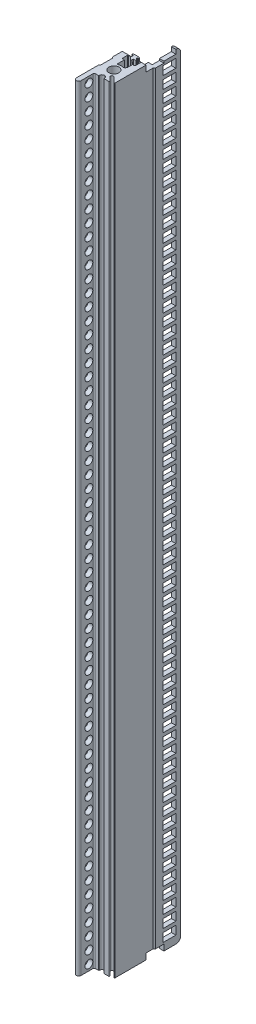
SolidWorks part; units mm, degrees
ref_plane "前视基准面" through (0, 0, 0) normal (0, 0, 1) x (1, 0, 0)
ref_plane "上视基准面" through (0, 0, 0) normal (0, 1, 0) x (1, 0, 0)
ref_plane "右视基准面" through (0, 0, 0) normal (1, 0, 0) x (0, 0, -1)
sketch "草图1" plane through (0, 0, 0) normal (0, 1, 0) x (1, 0, 0)
  line L0 (-4.2, 11.9) -> (-3.9, 11.9)
  line L1 (-4.4, 12.2) -> (-4.4, 12.1)
  line L2 (-4.0328, 12.4) -> (-4.2, 12.4)
  line L3 (-3.85, 12.5) -> (-3.8914, 12.4586)
  line L4 (-2.05, 12.5) -> (-3.85, 12.5)
  line L5 (-2.0086, 12.4586) -> (-2.05, 12.5)
  line L6 (-1.7, 12.4) -> (-1.8672, 12.4)
  line L7 (-1.5, 12.1) -> (-1.5, 12.2)
  line L8 (-1.8, 11.9) -> (-1.7, 11.9)
  line L9 (-2, 11.4828) -> (-2, 11.7)
  line L10 (-1.3586, 10.7586) -> (-1.9414, 11.3414)
  line L11 (-1.3, 10.55) -> (-1.3, 10.6172)
  line L12 (-3.7, 11.7) -> (-3.7, 9.95)
  line L13 (-5, -10.75) -> (-5, -1.6)
  line L14 (-3, -10.75) -> (-3, -5.75)
  line L15 (-2.5, -5.25) -> (-1.15, -5.25)
  line L16 (1.6887, -3.3855) -> (3.2118, -4.9086)
  line L17 (2.5373, -2.537) -> (4.6586, -4.6583)
  line L18 (5, 15) -> (5, 5.1793)
  line L19 (3.6, 15) -> (5, 15)
  line L20 (3.6, 12.5) -> (3.6, 15)
  line L21 (1.95, 12.5) -> (3.6, 12.5)
  line L22 (1.95, 10.55) -> (1.95, 12.5)
  line L23 (2.85, 10.55) -> (1.95, 10.55)
  line L24 (2.85, 9.35) -> (2.85, 10.55)
  line L25 (1.95, 9.35) -> (2.85, 9.35)
  line L26 (1.95, 8.35) -> (1.95, 9.35)
  line L27 (2.85, 8.35) -> (1.95, 8.35)
  line L28 (2.85, 6.05) -> (2.85, 8.35)
  line L29 (1.95, 6.05) -> (2.85, 6.05)
  line L30 (1.95, 3.8856) -> (1.95, 6.05)
  line L31 (-1.45, 6.05) -> (-1.45, 2.9458)
  line L32 (-2.35, 6.05) -> (-1.45, 6.05)
  line L33 (-2.35, 8.35) -> (-2.35, 6.05)
  line L34 (-1.45, 8.35) -> (-2.35, 8.35)
  line L35 (-1.45, 9.35) -> (-1.45, 8.35)
  line L36 (-2.35, 9.35) -> (-1.45, 9.35)
  line L37 (-2.35, 10.55) -> (-2.35, 9.35)
  line L38 (-1.3, 10.55) -> (-2.35, 10.55)
  line L39 (-4.45, 7.7) -> (-4.7, 7.7) construction
  line L40 (-5, 7.4) -> (-4.7, 7.7) construction
  line L41 (-5, 4.4) -> (-5, 7.4)
  line L42 (-4.5499, 3.8998) -> (-5, 4.4)
  line L43 (-4.45, 8.5) -> (-4.45, 9.55)
  line L44 (-3.9, 9.75) -> (-4.25, 9.75)
  line L45 (-4.5499, 3.8998) -> (-4.5501, -1.1002)
  line L46 (-5, -1.6) -> (-4.5501, -1.1002)
  line L47 (4.9414, -1.9395) -> (4.6464, -1.6446) construction
  line L48 (5, -2.081) -> (5, -4.5169)
  line L49 (0, 0) -> (0, -5) construction
  line L50 (4.5, -1.291) -> (4.5, 4.3894) construction
  line L51 (-1.05, -5) -> (-1.05, -5.15)
  line L52 (1.05, -5) -> (1.05, -5.15)
  line L53 (1.15, -5.25) -> (3.0703, -5.25)
  line L54 (2.5373, -2.537) -> (1.6887, -3.3855) construction
  line L55 (5, 5.1793) -> (5, -2.081)
  line L56 (-4.45, 8.5) -> (-4.7, 8.5)
  line L57 (-4.7, 8.5) -> (-5, 8.2)
  line L58 (4.9414, 5.0379) -> (4.6464, 4.743) construction
  line L59 (-5, 8.2) -> (-5, 7.4)
  circle A0 centre (0, 0) radius 1.6
  arc A1 (-4.4, 12.1) -> (-4.2, 11.9) centre (-4.2, 12.1) ccw
  arc A2 (-4.2, 12.4) -> (-4.4, 12.2) centre (-4.2, 12.2) ccw
  arc A3 (-4.0328, 12.4) -> (-3.8914, 12.4586) centre (-4.0328, 12.6) ccw
  arc A4 (-2.0086, 12.4586) -> (-1.8672, 12.4) centre (-1.8672, 12.6) ccw
  arc A5 (-1.5, 12.2) -> (-1.7, 12.4) centre (-1.7, 12.2) ccw
  arc A6 (-1.7, 11.9) -> (-1.5, 12.1) centre (-1.7, 12.1) ccw
  arc A7 (-1.8, 11.9) -> (-2, 11.7) centre (-1.8, 11.7) ccw
  arc A8 (-2, 11.4828) -> (-1.9414, 11.3414) centre (-1.8, 11.4828) ccw
  arc A9 (-1.3, 10.6172) -> (-1.3586, 10.7586) centre (-1.5, 10.6172) ccw
  arc A10 (-5, -10.75) -> (-3, -10.75) centre (-4, -10.75) ccw
  arc A11 (3.0703, -5.25) -> (3.2118, -4.9086) centre (3.0703, -5.05) ccw
  arc A12 (-4.25, 9.75) -> (-4.45, 9.55) centre (-4.25, 9.55) ccw
  arc A13 (-3.9, 9.75) -> (-3.7, 9.95) centre (-3.9, 9.95) ccw
  arc A14 (5, -2.081) -> (4.9414, -1.9395) centre (4.8, -2.081) ccw construction
  arc A15 (4.9414, 5.0379) -> (5, 5.1793) centre (4.8, 5.1793) ccw construction
  arc A16 (4.6586, -4.6583) -> (5, -4.5169) centre (4.8, -4.5169) ccw
  arc A17 (2.5373, -2.537) -> (1.6887, -3.3855) centre (2.113, -2.9613) ccw
  arc A18 (0.7125, 2.9142) -> (-1.1719, 2.7616) centre (0, 0) ccw
  arc A19 (-1.45, 2.9458) -> (-1.1719, 2.7616) centre (-1.25, 2.9458) ccw
  arc A20 (0.7125, 2.9142) -> (1.95, 3.8856) centre (0.95, 3.8856) ccw
  arc A21 (-3.7, 11.7) -> (-3.9, 11.9) centre (-3.9, 11.7) ccw
  arc A22 (4.6464, -1.6446) -> (4.5, -1.291) centre (5, -1.291) cw construction
  arc A23 (4.5, 4.3894) -> (4.6464, 4.743) centre (5, 4.3894) cw construction
  arc A24 (1.05, -5) -> (-1.05, -5) centre (0, -5) ccw
  arc A25 (1.15, -5.25) -> (1.05, -5.15) centre (1.15, -5.15) cw
  arc A26 (-1.05, -5.15) -> (-1.15, -5.25) centre (-1.15, -5.15) cw
  arc A29 (-3, -5.75) -> (-2.5, -5.25) centre (-2.5, -5.75) cw
  point P104 (1.05, -5.25)
  dimension "D1" = 3.2
  dimension "D2" = 2.1
  dimension "D3" = 5.2
  dimension "D4" = 45
  dimension "D5" = 1.2
  dimension "D7" = 0.6
  dimension "D8" = 0.2
  dimension "D10" = 5
  dimension "D11" = 0.1
  dimension "D12" = 0.5
  dimension "D13" = 0.5
  dimension "D6" = 3
  dimension "D9" = 2.1225
  dimension "D14" = 0.25
  dimension "D15" = 0.8
extrude "凸台-拉伸1" add sketch "草图1" along normal mid plane 325.12
sketch "草图8" plane through (0, -162.56, 0) normal (0, -1, 0) x (-1, 0, 0)
  line L0 (2.35, 8.35) -> (1.45, 8.35) construction
  line L1 (-2.95, 5.85) -> (2.45, 5.85)
  line L2 (-2.95, 5.85) -> (-2.95, 8.35)
  line L3 (-2.95, 8.35) -> (2.45, 8.35)
  line L4 (2.45, 5.85) -> (2.45, 8.35)
  line L5 (-2.85, 8.35) -> (-2.85, 6.05) construction
  line L6 (2.35, 6.05) -> (2.35, 8.35) construction
  line L7 (1.45, 6.05) -> (2.35, 6.05) construction
  line L8 (-2.85, 9.35) -> (-1.95, 9.35) construction
  line L9 (-2.95, 9.35) -> (2.45, 9.35)
  line L10 (-2.95, 9.35) -> (-2.95, 10.55)
  line L11 (-2.95, 10.55) -> (2.45, 10.55)
  line L12 (2.45, 9.35) -> (2.45, 10.55)
  line L13 (2.35, 10.55) -> (1.3, 10.55) construction
  line L14 (-2.85, 10.55) -> (-2.85, 9.35) construction
  line L15 (2.35, 9.35) -> (2.35, 10.55) construction
  dimension "D1" = 0.1
  dimension "D2" = 0.1
  dimension "D3" = 0.2
  dimension "D4" = 0.1
  dimension "D5" = 0.1
extrude "切除-拉伸6" cut sketch "草图8" against normal through all
fillet "圆角2" radius 0.2 8 edges at (-2.45, 0, -5.85) (2.95, 0, -8.35) (2.95, 0, -5.85) (-2.45, 0, -8.35) (-2.45, 0, -9.35) (2.95, 0, -10.55) (2.95, 0, -9.35) (-2.45, 0, -10.55)
sketch "草图6" plane through (0, 162.56, 0) normal (0, 1, 0) x (1, 0, 0)
  line L0 (3.6, 12.5) -> (3.6, 22.5)
  line L1 (3.6, 22.5) -> (5.5, 22.5)
  line L2 (5.5, 22.5) -> (5.5, 12)
  line L3 (5.5, 12) -> (5, 11.5)
  line L4 (3.6, 12.5) -> (5, 11.5)
  line L5 (5, -4.5169) -> (5, 15) construction
  line L6 (-5, 8.2) -> (-5, 4.4) construction
  dimension "D4" = 11
  dimension "D1" = 10.5
  dimension "D2" = 10
  dimension "D3" = 45
extrude "凸台-拉伸2" add sketch "草图6" against normal up to surface (325.12 mm away)
sketch "草图2" plane through (0, 162.56, 0) normal (0, 1, 0) x (1, 0, 0)
  circle A0 centre (0, 0) radius 2.1
  dimension "D1" = 4.2
extrude "切除-拉伸1" cut sketch "草图2" against normal blind 10
sketch "草图3" plane through (0, -162.56, 0) normal (0, -1, 0) x (1, 0, 0)
  circle A0 centre (0, 0) radius 2.1
  dimension "D1" = 4.2
extrude "切除-拉伸2" cut sketch "草图3" against normal blind 10
sketch "草图4" plane through (-5, 0, 0) normal (-1, 0, 0) x (0, 0, 1)
  line L0 (1.6, -162.56) -> (10.75, -162.56) construction
  line L1 (11.75, -162.56) -> (11.75, 162.56) construction
  circle A0 centre (7.5, -160.02) radius 1.65
  circle A1 centre (7.5, -154.94) radius 1.65
  circle A2 centre (7.5, -149.86) radius 1.65
  circle A3 centre (7.5, -144.78) radius 1.65
  circle A4 centre (7.5, -139.7) radius 1.65
  circle A5 centre (7.5, -134.62) radius 1.65
  circle A6 centre (7.5, -129.54) radius 1.65
  circle A7 centre (7.5, -124.46) radius 1.65
  circle A8 centre (7.5, -119.38) radius 1.65
  circle A9 centre (7.5, -114.3) radius 1.65
  circle A10 centre (7.5, -109.22) radius 1.65
  circle A11 centre (7.5, -104.14) radius 1.65
  circle A12 centre (7.5, -99.06) radius 1.65
  circle A13 centre (7.5, -93.98) radius 1.65
  circle A14 centre (7.5, -88.9) radius 1.65
  circle A15 centre (7.5, -83.82) radius 1.65
  circle A16 centre (7.5, -78.74) radius 1.65
  circle A17 centre (7.5, -73.66) radius 1.65
  circle A18 centre (7.5, -68.58) radius 1.65
  circle A19 centre (7.5, -63.5) radius 1.65
  circle A20 centre (7.5, -58.42) radius 1.65
  circle A21 centre (7.5, -53.34) radius 1.65
  circle A22 centre (7.5, -48.26) radius 1.65
  circle A23 centre (7.5, -43.18) radius 1.65
  circle A24 centre (7.5, -38.1) radius 1.65
  circle A25 centre (7.5, -33.02) radius 1.65
  circle A26 centre (7.5, -27.94) radius 1.65
  circle A27 centre (7.5, -22.86) radius 1.65
  circle A28 centre (7.5, -17.78) radius 1.65
  circle A29 centre (7.5, -12.7) radius 1.65
  circle A30 centre (7.5, -7.62) radius 1.65
  circle A31 centre (7.5, -2.54) radius 1.65
  circle A32 centre (7.5, 2.54) radius 1.65
  circle A33 centre (7.5, 7.62) radius 1.65
  circle A34 centre (7.5, 12.7) radius 1.65
  circle A35 centre (7.5, 17.78) radius 1.65
  circle A36 centre (7.5, 22.86) radius 1.65
  circle A37 centre (7.5, 27.94) radius 1.65
  circle A38 centre (7.5, 33.02) radius 1.65
  circle A39 centre (7.5, 38.1) radius 1.65
  circle A40 centre (7.5, 43.18) radius 1.65
  circle A41 centre (7.5, 48.26) radius 1.65
  circle A42 centre (7.5, 53.34) radius 1.65
  circle A43 centre (7.5, 58.42) radius 1.65
  circle A44 centre (7.5, 63.5) radius 1.65
  circle A45 centre (7.5, 68.58) radius 1.65
  circle A46 centre (7.5, 73.66) radius 1.65
  circle A47 centre (7.5, 78.74) radius 1.65
  circle A48 centre (7.5, 83.82) radius 1.65
  circle A49 centre (7.5, 88.9) radius 1.65
  circle A50 centre (7.5, 93.98) radius 1.65
  circle A51 centre (7.5, 99.06) radius 1.65
  circle A52 centre (7.5, 104.14) radius 1.65
  circle A53 centre (7.5, 109.22) radius 1.65
  circle A54 centre (7.5, 114.3) radius 1.65
  circle A55 centre (7.5, 119.38) radius 1.65
  circle A56 centre (7.5, 124.46) radius 1.65
  circle A57 centre (7.5, 129.54) radius 1.65
  circle A58 centre (7.5, 134.62) radius 1.65
  circle A59 centre (7.5, 139.7) radius 1.65
  circle A60 centre (7.5, 144.78) radius 1.65
  circle A61 centre (7.5, 149.86) radius 1.65
  circle A62 centre (7.5, 154.94) radius 1.65
  circle A63 centre (7.5, 160.02) radius 1.65
  circle A64 centre (7.5, 165.1) radius 1.65
  circle A65 centre (7.5, 170.18) radius 1.65
  circle A66 centre (7.5, 175.26) radius 1.65
  circle A67 centre (7.5, 180.34) radius 1.65
  circle A68 centre (7.5, 185.42) radius 1.65
  circle A69 centre (7.5, 190.5) radius 1.65
  circle A70 centre (7.5, 195.58) radius 1.65
  circle A71 centre (7.5, 200.66) radius 1.65
  circle A72 centre (7.5, 205.74) radius 1.65
  circle A73 centre (7.5, 210.82) radius 1.65
  circle A74 centre (7.5, 215.9) radius 1.65
  circle A75 centre (7.5, 220.98) radius 1.65
  circle A76 centre (7.5, 226.06) radius 1.65
  circle A77 centre (7.5, 231.14) radius 1.65
  circle A78 centre (7.5, 236.22) radius 1.65
  circle A79 centre (7.5, 241.3) radius 1.65
  circle A80 centre (7.5, 246.38) radius 1.65
  circle A81 centre (7.5, 251.46) radius 1.65
  circle A82 centre (7.5, 256.54) radius 1.65
  circle A83 centre (7.5, 261.62) radius 1.65
  circle A84 centre (7.5, 266.7) radius 1.65
  dimension "D1" = 2.54
  dimension "D2" = 4.25
  dimension "D3" = 3.3
  dimension "D5" = 5.08
  dimension "D4" = 85
extrude "切除-拉伸3" cut sketch "草图4" against normal blind 12
sketch "草图5" plane through (5.5, 0, 0) normal (1, 0, 0) x (0, 0, -1)
  line L0 (-19.1753, 0) -> (41.1348, 0) construction
  line L1 (15.5, 162.56) -> (8.5, 162.56)
  line L2 (15.5, 162.56) -> (15.5, 160.02)
  line L3 (15.5, 160.02) -> (8.5, 160.02)
  line L4 (8.5, 162.56) -> (8.5, 160.02)
  line L6 (8.5, -162.56) -> (8.5, -160.02)
  line L7 (15.5, -160.02) -> (8.5, -160.02)
  line L8 (15.5, -162.56) -> (15.5, -160.02)
  line L9 (15.5, -162.56) -> (8.5, -162.56)
  line L10 (12, 162.56) -> (22.5, 162.56) construction
  line L11 (22.5, -162.56) -> (22.5, 162.56) construction
  dimension "D1" = 7
  dimension "D2" = 2.54
  dimension "D3" = 7
extrude "切除-拉伸4" cut sketch "草图5" against normal through all
sketch "草图7" plane through (5.5, 0, 0) normal (1, 0, 0) x (0, 0, -1)
  line L0 (22.5, -162.56) -> (22.5, 162.56) construction
  line L1 (15, -159.28) -> (20.5, -159.28)
  line L2 (15, -159.28) -> (15, -155.68)
  line L3 (15, -155.68) -> (20.5, -155.68)
  line L4 (20.5, -159.28) -> (20.5, -155.68)
  line L5 (22.5, -162.56) -> (15.5, -162.56) construction
  line L6 (15, -154.2) -> (20.5, -154.2)
  line L7 (15, -154.2) -> (15, -150.6)
  line L8 (15, -150.6) -> (20.5, -150.6)
  line L9 (20.5, -154.2) -> (20.5, -150.6)
  line L10 (15, -149.12) -> (20.5, -149.12)
  line L11 (15, -149.12) -> (15, -145.52)
  line L12 (15, -145.52) -> (20.5, -145.52)
  line L13 (20.5, -149.12) -> (20.5, -145.52)
  line L14 (15, -144.04) -> (20.5, -144.04)
  line L15 (15, -144.04) -> (15, -140.44)
  line L16 (15, -140.44) -> (20.5, -140.44)
  line L17 (20.5, -144.04) -> (20.5, -140.44)
  line L18 (15, -138.96) -> (20.5, -138.96)
  line L19 (15, -138.96) -> (15, -135.36)
  line L20 (15, -135.36) -> (20.5, -135.36)
  line L21 (20.5, -138.96) -> (20.5, -135.36)
  line L22 (15, -133.88) -> (20.5, -133.88)
  line L23 (15, -133.88) -> (15, -130.28)
  line L24 (15, -130.28) -> (20.5, -130.28)
  line L25 (20.5, -133.88) -> (20.5, -130.28)
  line L26 (15, -128.8) -> (20.5, -128.8)
  line L27 (15, -128.8) -> (15, -125.2)
  line L28 (15, -125.2) -> (20.5, -125.2)
  line L29 (20.5, -128.8) -> (20.5, -125.2)
  line L30 (15, -123.72) -> (20.5, -123.72)
  line L31 (15, -123.72) -> (15, -120.12)
  line L32 (15, -120.12) -> (20.5, -120.12)
  line L33 (20.5, -123.72) -> (20.5, -120.12)
  line L34 (15, -118.64) -> (20.5, -118.64)
  line L35 (15, -118.64) -> (15, -115.04)
  line L36 (15, -115.04) -> (20.5, -115.04)
  line L37 (20.5, -118.64) -> (20.5, -115.04)
  line L38 (15, -113.56) -> (20.5, -113.56)
  line L39 (15, -113.56) -> (15, -109.96)
  line L40 (15, -109.96) -> (20.5, -109.96)
  line L41 (20.5, -113.56) -> (20.5, -109.96)
  line L42 (15, -108.48) -> (20.5, -108.48)
  line L43 (15, -108.48) -> (15, -104.88)
  line L44 (15, -104.88) -> (20.5, -104.88)
  line L45 (20.5, -108.48) -> (20.5, -104.88)
  line L46 (15, -103.4) -> (20.5, -103.4)
  line L47 (15, -103.4) -> (15, -99.8)
  line L48 (15, -99.8) -> (20.5, -99.8)
  line L49 (20.5, -103.4) -> (20.5, -99.8)
  line L50 (15, -98.32) -> (20.5, -98.32)
  line L51 (15, -98.32) -> (15, -94.72)
  line L52 (15, -94.72) -> (20.5, -94.72)
  line L53 (20.5, -98.32) -> (20.5, -94.72)
  line L54 (15, -93.24) -> (20.5, -93.24)
  line L55 (15, -93.24) -> (15, -89.64)
  line L56 (15, -89.64) -> (20.5, -89.64)
  line L57 (20.5, -93.24) -> (20.5, -89.64)
  line L58 (15, -88.16) -> (20.5, -88.16)
  line L59 (15, -88.16) -> (15, -84.56)
  line L60 (15, -84.56) -> (20.5, -84.56)
  line L61 (20.5, -88.16) -> (20.5, -84.56)
  line L62 (15, -83.08) -> (20.5, -83.08)
  line L63 (15, -83.08) -> (15, -79.48)
  line L64 (15, -79.48) -> (20.5, -79.48)
  line L65 (20.5, -83.08) -> (20.5, -79.48)
  line L66 (15, -78) -> (20.5, -78)
  line L67 (15, -78) -> (15, -74.4)
  line L68 (15, -74.4) -> (20.5, -74.4)
  line L69 (20.5, -78) -> (20.5, -74.4)
  line L70 (15, -72.92) -> (20.5, -72.92)
  line L71 (15, -72.92) -> (15, -69.32)
  line L72 (15, -69.32) -> (20.5, -69.32)
  line L73 (20.5, -72.92) -> (20.5, -69.32)
  line L74 (15, -67.84) -> (20.5, -67.84)
  line L75 (15, -67.84) -> (15, -64.24)
  line L76 (15, -64.24) -> (20.5, -64.24)
  line L77 (20.5, -67.84) -> (20.5, -64.24)
  line L78 (15, -62.76) -> (20.5, -62.76)
  line L79 (15, -62.76) -> (15, -59.16)
  line L80 (15, -59.16) -> (20.5, -59.16)
  line L81 (20.5, -62.76) -> (20.5, -59.16)
  line L82 (15, -57.68) -> (20.5, -57.68)
  line L83 (15, -57.68) -> (15, -54.08)
  line L84 (15, -54.08) -> (20.5, -54.08)
  line L85 (20.5, -57.68) -> (20.5, -54.08)
  line L86 (15, -52.6) -> (20.5, -52.6)
  line L87 (15, -52.6) -> (15, -49)
  line L88 (15, -49) -> (20.5, -49)
  line L89 (20.5, -52.6) -> (20.5, -49)
  line L90 (15, -47.52) -> (20.5, -47.52)
  line L91 (15, -47.52) -> (15, -43.92)
  line L92 (15, -43.92) -> (20.5, -43.92)
  line L93 (20.5, -47.52) -> (20.5, -43.92)
  line L94 (15, -42.44) -> (20.5, -42.44)
  line L95 (15, -42.44) -> (15, -38.84)
  line L96 (15, -38.84) -> (20.5, -38.84)
  line L97 (20.5, -42.44) -> (20.5, -38.84)
  line L98 (15, -37.36) -> (20.5, -37.36)
  line L99 (15, -37.36) -> (15, -33.76)
  line L100 (15, -33.76) -> (20.5, -33.76)
  line L101 (20.5, -37.36) -> (20.5, -33.76)
  line L102 (15, -32.28) -> (20.5, -32.28)
  line L103 (15, -32.28) -> (15, -28.68)
  line L104 (15, -28.68) -> (20.5, -28.68)
  line L105 (20.5, -32.28) -> (20.5, -28.68)
  line L106 (15, -27.2) -> (20.5, -27.2)
  line L107 (15, -27.2) -> (15, -23.6)
  line L108 (15, -23.6) -> (20.5, -23.6)
  line L109 (20.5, -27.2) -> (20.5, -23.6)
  line L110 (15, -22.12) -> (20.5, -22.12)
  line L111 (15, -22.12) -> (15, -18.52)
  line L112 (15, -18.52) -> (20.5, -18.52)
  line L113 (20.5, -22.12) -> (20.5, -18.52)
  line L114 (15, -17.04) -> (20.5, -17.04)
  line L115 (15, -17.04) -> (15, -13.44)
  line L116 (15, -13.44) -> (20.5, -13.44)
  line L117 (20.5, -17.04) -> (20.5, -13.44)
  line L118 (15, -11.96) -> (20.5, -11.96)
  line L119 (15, -11.96) -> (15, -8.36)
  line L120 (15, -8.36) -> (20.5, -8.36)
  line L121 (20.5, -11.96) -> (20.5, -8.36)
  line L122 (15, -6.88) -> (20.5, -6.88)
  line L123 (15, -6.88) -> (15, -3.28)
  line L124 (15, -3.28) -> (20.5, -3.28)
  line L125 (20.5, -6.88) -> (20.5, -3.28)
  line L126 (15, -1.8) -> (20.5, -1.8)
  line L127 (15, -1.8) -> (15, 1.8)
  line L128 (15, 1.8) -> (20.5, 1.8)
  line L129 (20.5, -1.8) -> (20.5, 1.8)
  line L130 (15, 3.28) -> (20.5, 3.28)
  line L131 (15, 3.28) -> (15, 6.88)
  line L132 (15, 6.88) -> (20.5, 6.88)
  line L133 (20.5, 3.28) -> (20.5, 6.88)
  line L134 (15, 8.36) -> (20.5, 8.36)
  line L135 (15, 8.36) -> (15, 11.96)
  line L136 (15, 11.96) -> (20.5, 11.96)
  line L137 (20.5, 8.36) -> (20.5, 11.96)
  line L138 (15, 13.44) -> (20.5, 13.44)
  line L139 (15, 13.44) -> (15, 17.04)
  line L140 (15, 17.04) -> (20.5, 17.04)
  line L141 (20.5, 13.44) -> (20.5, 17.04)
  line L142 (15, 18.52) -> (20.5, 18.52)
  line L143 (15, 18.52) -> (15, 22.12)
  line L144 (15, 22.12) -> (20.5, 22.12)
  line L145 (20.5, 18.52) -> (20.5, 22.12)
  line L146 (15, 23.6) -> (20.5, 23.6)
  line L147 (15, 23.6) -> (15, 27.2)
  line L148 (15, 27.2) -> (20.5, 27.2)
  line L149 (20.5, 23.6) -> (20.5, 27.2)
  line L150 (15, 28.68) -> (20.5, 28.68)
  line L151 (15, 28.68) -> (15, 32.28)
  line L152 (15, 32.28) -> (20.5, 32.28)
  line L153 (20.5, 28.68) -> (20.5, 32.28)
  line L154 (15, 33.76) -> (20.5, 33.76)
  line L155 (15, 33.76) -> (15, 37.36)
  line L156 (15, 37.36) -> (20.5, 37.36)
  line L157 (20.5, 33.76) -> (20.5, 37.36)
  line L158 (15, 38.84) -> (20.5, 38.84)
  line L159 (15, 38.84) -> (15, 42.44)
  line L160 (15, 42.44) -> (20.5, 42.44)
  line L161 (20.5, 38.84) -> (20.5, 42.44)
  line L162 (15, 43.92) -> (20.5, 43.92)
  line L163 (15, 43.92) -> (15, 47.52)
  line L164 (15, 47.52) -> (20.5, 47.52)
  line L165 (20.5, 43.92) -> (20.5, 47.52)
  line L166 (15, 49) -> (20.5, 49)
  line L167 (15, 49) -> (15, 52.6)
  line L168 (15, 52.6) -> (20.5, 52.6)
  line L169 (20.5, 49) -> (20.5, 52.6)
  line L170 (15, 54.08) -> (20.5, 54.08)
  line L171 (15, 54.08) -> (15, 57.68)
  line L172 (15, 57.68) -> (20.5, 57.68)
  line L173 (20.5, 54.08) -> (20.5, 57.68)
  line L174 (15, 59.16) -> (20.5, 59.16)
  line L175 (15, 59.16) -> (15, 62.76)
  line L176 (15, 62.76) -> (20.5, 62.76)
  line L177 (20.5, 59.16) -> (20.5, 62.76)
  line L178 (15, 64.24) -> (20.5, 64.24)
  line L179 (15, 64.24) -> (15, 67.84)
  line L180 (15, 67.84) -> (20.5, 67.84)
  line L181 (20.5, 64.24) -> (20.5, 67.84)
  line L182 (15, 69.32) -> (20.5, 69.32)
  line L183 (15, 69.32) -> (15, 72.92)
  line L184 (15, 72.92) -> (20.5, 72.92)
  line L185 (20.5, 69.32) -> (20.5, 72.92)
  line L186 (15, 74.4) -> (20.5, 74.4)
  line L187 (15, 74.4) -> (15, 78)
  line L188 (15, 78) -> (20.5, 78)
  line L189 (20.5, 74.4) -> (20.5, 78)
  line L190 (15, 79.48) -> (20.5, 79.48)
  line L191 (15, 79.48) -> (15, 83.08)
  line L192 (15, 83.08) -> (20.5, 83.08)
  line L193 (20.5, 79.48) -> (20.5, 83.08)
  line L194 (15, 84.56) -> (20.5, 84.56)
  line L195 (15, 84.56) -> (15, 88.16)
  line L196 (15, 88.16) -> (20.5, 88.16)
  line L197 (20.5, 84.56) -> (20.5, 88.16)
  line L198 (15, 89.64) -> (20.5, 89.64)
  line L199 (15, 89.64) -> (15, 93.24)
  line L200 (15, 93.24) -> (20.5, 93.24)
  line L201 (20.5, 89.64) -> (20.5, 93.24)
  line L202 (15, 94.72) -> (20.5, 94.72)
  line L203 (15, 94.72) -> (15, 98.32)
  line L204 (15, 98.32) -> (20.5, 98.32)
  line L205 (20.5, 94.72) -> (20.5, 98.32)
  line L206 (15, 99.8) -> (20.5, 99.8)
  line L207 (15, 99.8) -> (15, 103.4)
  line L208 (15, 103.4) -> (20.5, 103.4)
  line L209 (20.5, 99.8) -> (20.5, 103.4)
  line L210 (15, 104.88) -> (20.5, 104.88)
  line L211 (15, 104.88) -> (15, 108.48)
  line L212 (15, 108.48) -> (20.5, 108.48)
  line L213 (20.5, 104.88) -> (20.5, 108.48)
  line L214 (15, 109.96) -> (20.5, 109.96)
  line L215 (15, 109.96) -> (15, 113.56)
  line L216 (15, 113.56) -> (20.5, 113.56)
  line L217 (20.5, 109.96) -> (20.5, 113.56)
  line L218 (15, 115.04) -> (20.5, 115.04)
  line L219 (15, 115.04) -> (15, 118.64)
  line L220 (15, 118.64) -> (20.5, 118.64)
  line L221 (20.5, 115.04) -> (20.5, 118.64)
  line L222 (15, 120.12) -> (20.5, 120.12)
  line L223 (15, 120.12) -> (15, 123.72)
  line L224 (15, 123.72) -> (20.5, 123.72)
  line L225 (20.5, 120.12) -> (20.5, 123.72)
  line L226 (15, 125.2) -> (20.5, 125.2)
  line L227 (15, 125.2) -> (15, 128.8)
  line L228 (15, 128.8) -> (20.5, 128.8)
  line L229 (20.5, 125.2) -> (20.5, 128.8)
  line L230 (15, 130.28) -> (20.5, 130.28)
  line L231 (15, 130.28) -> (15, 133.88)
  line L232 (15, 133.88) -> (20.5, 133.88)
  line L233 (20.5, 130.28) -> (20.5, 133.88)
  line L234 (15, 135.36) -> (20.5, 135.36)
  line L235 (15, 135.36) -> (15, 138.96)
  line L236 (15, 138.96) -> (20.5, 138.96)
  line L237 (20.5, 135.36) -> (20.5, 138.96)
  line L238 (15, 140.44) -> (20.5, 140.44)
  line L239 (15, 140.44) -> (15, 144.04)
  line L240 (15, 144.04) -> (20.5, 144.04)
  line L241 (20.5, 140.44) -> (20.5, 144.04)
  line L242 (15, 145.52) -> (20.5, 145.52)
  line L243 (15, 145.52) -> (15, 149.12)
  line L244 (15, 149.12) -> (20.5, 149.12)
  line L245 (20.5, 145.52) -> (20.5, 149.12)
  line L246 (15, 150.6) -> (20.5, 150.6)
  line L247 (15, 150.6) -> (15, 154.2)
  line L248 (15, 154.2) -> (20.5, 154.2)
  line L249 (20.5, 150.6) -> (20.5, 154.2)
  line L250 (15, 155.68) -> (20.5, 155.68)
  line L251 (15, 155.68) -> (15, 159.28)
  line L252 (15, 159.28) -> (20.5, 159.28)
  line L253 (20.5, 155.68) -> (20.5, 159.28)
  line L254 (15, 160.76) -> (20.5, 160.76)
  line L255 (15, 160.76) -> (15, 164.36)
  line L256 (15, 164.36) -> (20.5, 164.36)
  line L257 (20.5, 160.76) -> (20.5, 164.36)
  line L258 (15, 165.84) -> (20.5, 165.84)
  line L259 (15, 165.84) -> (15, 169.44)
  line L260 (15, 169.44) -> (20.5, 169.44)
  line L261 (20.5, 165.84) -> (20.5, 169.44)
  line L262 (15, 170.92) -> (20.5, 170.92)
  line L263 (15, 170.92) -> (15, 174.52)
  line L264 (15, 174.52) -> (20.5, 174.52)
  line L265 (20.5, 170.92) -> (20.5, 174.52)
  line L266 (15, 176) -> (20.5, 176)
  line L267 (15, 176) -> (15, 179.6)
  line L268 (15, 179.6) -> (20.5, 179.6)
  line L269 (20.5, 176) -> (20.5, 179.6)
  line L270 (15, 181.08) -> (20.5, 181.08)
  line L271 (15, 181.08) -> (15, 184.68)
  line L272 (15, 184.68) -> (20.5, 184.68)
  line L273 (20.5, 181.08) -> (20.5, 184.68)
  line L274 (15, 186.16) -> (20.5, 186.16)
  line L275 (15, 186.16) -> (15, 189.76)
  line L276 (15, 189.76) -> (20.5, 189.76)
  line L277 (20.5, 186.16) -> (20.5, 189.76)
  line L278 (15, 191.24) -> (20.5, 191.24)
  line L279 (15, 191.24) -> (15, 194.84)
  line L280 (15, 194.84) -> (20.5, 194.84)
  line L281 (20.5, 191.24) -> (20.5, 194.84)
  line L282 (15, 196.32) -> (20.5, 196.32)
  line L283 (15, 196.32) -> (15, 199.92)
  line L284 (15, 199.92) -> (20.5, 199.92)
  line L285 (20.5, 196.32) -> (20.5, 199.92)
  line L286 (15, 201.4) -> (20.5, 201.4)
  line L287 (15, 201.4) -> (15, 205)
  line L288 (15, 205) -> (20.5, 205)
  line L289 (20.5, 201.4) -> (20.5, 205)
  line L290 (15, 206.48) -> (20.5, 206.48)
  line L291 (15, 206.48) -> (15, 210.08)
  line L292 (15, 210.08) -> (20.5, 210.08)
  line L293 (20.5, 206.48) -> (20.5, 210.08)
  line L294 (15, 211.56) -> (20.5, 211.56)
  line L295 (15, 211.56) -> (15, 215.16)
  line L296 (15, 215.16) -> (20.5, 215.16)
  line L297 (20.5, 211.56) -> (20.5, 215.16)
  line L298 (15, 216.64) -> (20.5, 216.64)
  line L299 (15, 216.64) -> (15, 220.24)
  line L300 (15, 220.24) -> (20.5, 220.24)
  line L301 (20.5, 216.64) -> (20.5, 220.24)
  line L302 (15, 221.72) -> (20.5, 221.72)
  line L303 (15, 221.72) -> (15, 225.32)
  line L304 (15, 225.32) -> (20.5, 225.32)
  line L305 (20.5, 221.72) -> (20.5, 225.32)
  line L306 (15, 226.8) -> (20.5, 226.8)
  line L307 (15, 226.8) -> (15, 230.4)
  line L308 (15, 230.4) -> (20.5, 230.4)
  line L309 (20.5, 226.8) -> (20.5, 230.4)
  line L310 (15, 231.88) -> (20.5, 231.88)
  line L311 (15, 231.88) -> (15, 235.48)
  line L312 (15, 235.48) -> (20.5, 235.48)
  line L313 (20.5, 231.88) -> (20.5, 235.48)
  line L314 (15, 236.96) -> (20.5, 236.96)
  line L315 (15, 236.96) -> (15, 240.56)
  line L316 (15, 240.56) -> (20.5, 240.56)
  line L317 (20.5, 236.96) -> (20.5, 240.56)
  line L318 (15, 242.04) -> (20.5, 242.04)
  line L319 (15, 242.04) -> (15, 245.64)
  line L320 (15, 245.64) -> (20.5, 245.64)
  line L321 (20.5, 242.04) -> (20.5, 245.64)
  line L322 (15, 247.12) -> (20.5, 247.12)
  line L323 (15, 247.12) -> (15, 250.72)
  line L324 (15, 250.72) -> (20.5, 250.72)
  line L325 (20.5, 247.12) -> (20.5, 250.72)
  line L326 (15, 252.2) -> (20.5, 252.2)
  line L327 (15, 252.2) -> (15, 255.8)
  line L328 (15, 255.8) -> (20.5, 255.8)
  line L329 (20.5, 252.2) -> (20.5, 255.8)
  line L330 (15, 257.28) -> (20.5, 257.28)
  line L331 (15, 257.28) -> (15, 260.88)
  line L332 (15, 260.88) -> (20.5, 260.88)
  line L333 (20.5, 257.28) -> (20.5, 260.88)
  line L334 (15, 262.36) -> (20.5, 262.36)
  line L335 (15, 262.36) -> (15, 265.96)
  line L336 (15, 265.96) -> (20.5, 265.96)
  line L337 (20.5, 262.36) -> (20.5, 265.96)
  dimension "D1" = 3.6
  dimension "D2" = 5.5
  dimension "D3" = 2
  dimension "D4" = 3.28
  dimension "D5" = 84
extrude "切除-拉伸5" cut sketch "草图7" against normal blind 10
fillet "圆角1" radius 2 2 edges at (4.55, -162.56, -22.5) (4.55, 162.56, -22.5)
